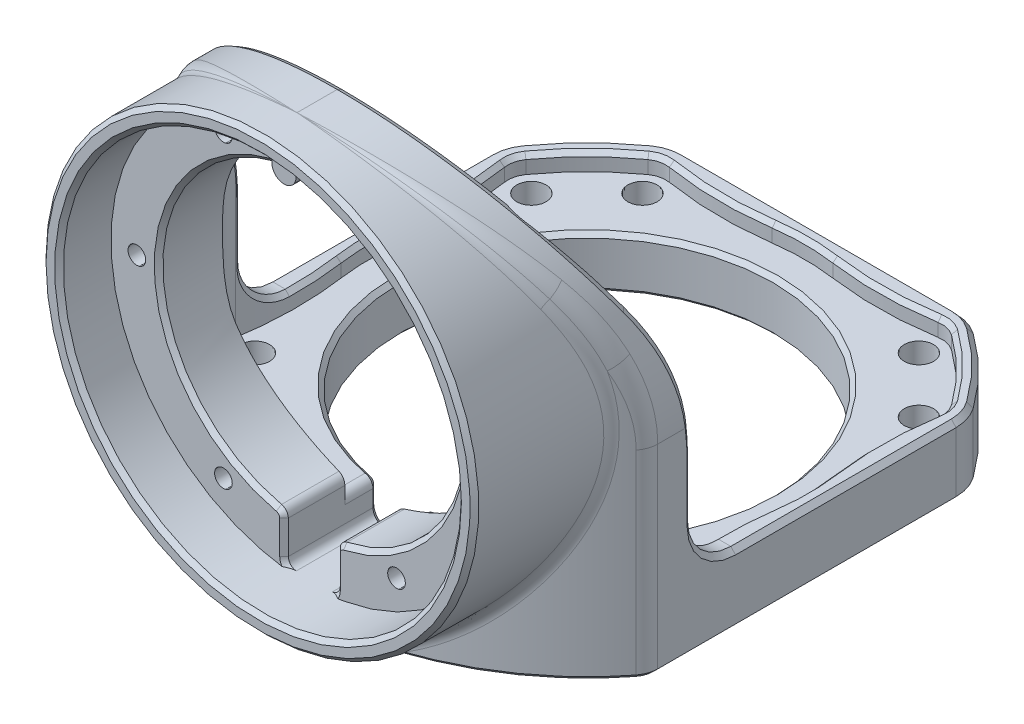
SolidWorks part; units mm, degrees
ref_plane "前视基准面" through (0, 0, 0) normal (0, 0, 1) x (1, 0, 0)
ref_plane "上视基准面" through (0, 0, 0) normal (0, 1, 0) x (1, 0, 0)
ref_plane "右视基准面" through (0, 0, 0) normal (1, 0, 0) x (0, 0, -1)
other "Configuration Table"
sketch "草图1" plane through (0, 0, 0) normal (0, 1, 0) x (1, 0, 0)
  line B0 (0, 0) -> (0, 37.6754) construction
  line B1 (0, 0) -> (41.9518, 0) construction
  arc B2 (15.5614, -24.8547) -> (3.4705, -24.7074) centre (9.0345, -64.3186) ccw
  arc B3 (15.5614, -24.8547) -> (17.4211, -24.4235) centre (15.9693, -22.3882) ccw
  arc B4 (17.4211, -24.4235) -> (24.4235, -17.4211) centre (0, 0) ccw
  arc B5 (24.4235, -17.4211) -> (24.8547, -15.5614) centre (22.3882, -15.9693) ccw
  arc B6 (24.7074, -3.4705) -> (24.8547, -15.5614) centre (64.3186, -9.0345) ccw
  arc B7 (24.7074, -3.4705) -> (24.7074, 3.4705) centre (0, 0) ccw
  arc B8 (24.8547, 15.5614) -> (24.7074, 3.4705) centre (64.3186, 9.0345) ccw
  arc B9 (24.8547, 15.5614) -> (24.4235, 17.4211) centre (22.3882, 15.9693) ccw
  arc B10 (24.4235, 17.4211) -> (17.4211, 24.4235) centre (0, 0) ccw
  arc B11 (17.4211, 24.4235) -> (15.5614, 24.8547) centre (15.9693, 22.3882) ccw
  arc B12 (3.4705, 24.7074) -> (15.5614, 24.8547) centre (9.0345, 64.3186) ccw
  arc B13 (3.4705, 24.7074) -> (-3.4705, 24.7074) centre (0, 0) ccw
  arc B14 (-15.5614, 24.8547) -> (-3.4705, 24.7074) centre (-9.0345, 64.3186) ccw
  arc B15 (-15.5614, 24.8547) -> (-17.4211, 24.4235) centre (-15.9693, 22.3882) ccw
  arc B16 (-17.4211, 24.4235) -> (-24.4235, 17.4211) centre (0, 0) ccw
  arc B17 (-24.4235, 17.4211) -> (-24.8547, 15.5614) centre (-22.3882, 15.9693) ccw
  arc B18 (-24.7074, 3.4705) -> (-24.8547, 15.5614) centre (-64.3186, 9.0345) ccw
  arc B19 (-24.7074, 3.4705) -> (-24.7074, -3.4705) centre (0, 0) ccw
  arc B20 (-24.8547, -15.5614) -> (-24.7074, -3.4705) centre (-64.3186, -9.0345) ccw
  arc B21 (-24.8547, -15.5614) -> (-24.4235, -17.4211) centre (-22.3882, -15.9693) ccw
  arc B22 (-24.4235, -17.4211) -> (-17.4211, -24.4235) centre (0, 0) ccw
  arc B23 (-17.4211, -24.4235) -> (-15.5614, -24.8547) centre (-15.9693, -22.3882) ccw
  arc B24 (-3.4705, -24.7074) -> (-15.5614, -24.8547) centre (-9.0345, -64.3186) ccw
  arc B25 (-3.4705, -24.7074) -> (3.4705, -24.7074) centre (0, 0) ccw
sketch_block_instance "块1-1"
sketch_block "块1"
sketch "草图2" plane through (0, 0, 0) normal (0, 1, 0) x (1, 0, 0)
  line L1 (-27, -27) -> (27, -27)
  line L2 (-27, -27) -> (-27, 27)
  line L3 (-27, 27) -> (27, 27)
  line L4 (27, -27) -> (27, 27)
  line L5 (-27, -27) -> (27, 27) construction
  line L6 (-27, 27) -> (27, -27) construction
  circle A0 centre (0, 0) radius 32
  arc A302 (24.4235, 17.4211) -> (17.4211, 24.4235) centre (0, 0) ccw construction
  circle A303 centre (0, 0) radius 33.5
  arc A304 (17.4211, -24.4235) -> (24.4235, -17.4211) centre (0, 0) ccw construction
  arc A326 (24.9055, -3.4984) -> (24.9055, 3.4984) centre (0, 0) ccw
  arc A327 (24.9055, -3.4984) -> (25.052, -15.5288) centre (64.3186, -9.0345) ccw
  arc A328 (24.5863, -17.5372) -> (25.052, -15.5288) centre (22.3882, -15.9693) ccw
  arc A329 (17.5372, -24.5863) -> (24.5863, -17.5372) centre (0, 0) ccw
  arc A330 (15.5288, -25.052) -> (17.5372, -24.5863) centre (15.9693, -22.3882) ccw
  arc A331 (15.5288, -25.052) -> (3.4984, -24.9055) centre (9.0345, -64.3186) ccw
  arc A332 (-3.4984, -24.9055) -> (3.4984, -24.9055) centre (0, 0) ccw
  arc A333 (-3.4984, -24.9055) -> (-15.5288, -25.052) centre (-9.0345, -64.3186) ccw
  arc A334 (-17.5372, -24.5863) -> (-15.5288, -25.052) centre (-15.9693, -22.3882) ccw
  arc A335 (-24.5863, -17.5372) -> (-17.5372, -24.5863) centre (0, 0) ccw
  arc A336 (-25.052, -15.5288) -> (-24.5863, -17.5372) centre (-22.3882, -15.9693) ccw
  arc A337 (-25.052, -15.5288) -> (-24.9055, -3.4984) centre (-64.3186, -9.0345) ccw
  arc A338 (-24.9055, 3.4984) -> (-24.9055, -3.4984) centre (0, 0) ccw
  arc A339 (-24.9055, 3.4984) -> (-25.052, 15.5288) centre (-64.3186, 9.0345) ccw
  arc A340 (-24.5863, 17.5372) -> (-25.052, 15.5288) centre (-22.3882, 15.9693) ccw
  arc A341 (-17.5372, 24.5863) -> (-24.5863, 17.5372) centre (0, 0) ccw
  arc A342 (-15.5288, 25.052) -> (-17.5372, 24.5863) centre (-15.9693, 22.3882) ccw
  arc A343 (-15.5288, 25.052) -> (-3.4984, 24.9055) centre (-9.0345, 64.3186) ccw
  arc A344 (3.4984, 24.9055) -> (-3.4984, 24.9055) centre (0, 0) ccw
  arc A345 (3.4984, 24.9055) -> (15.5288, 25.052) centre (9.0345, 64.3186) ccw
  arc A346 (17.5372, 24.5863) -> (15.5288, 25.052) centre (15.9693, 22.3882) ccw
  arc A347 (24.5863, 17.5372) -> (17.5372, 24.5863) centre (0, 0) ccw
  arc A348 (25.052, 15.5288) -> (24.5863, 17.5372) centre (22.3882, 15.9693) ccw
  arc A349 (25.052, 15.5288) -> (24.9055, 3.4984) centre (64.3186, 9.0345) ccw
  arc A350 (24.9055, -3.4984) -> (24.9055, 3.4984) centre (0, 0) ccw
  arc A351 (24.9055, -3.4984) -> (25.052, -15.5288) centre (64.3186, -9.0345) ccw
  arc A352 (24.5863, -17.5372) -> (25.052, -15.5288) centre (22.3882, -15.9693) ccw
  arc A353 (17.5372, -24.5863) -> (24.5863, -17.5372) centre (0, 0) ccw
  arc A354 (15.5288, -25.052) -> (17.5372, -24.5863) centre (15.9693, -22.3882) ccw
  arc A355 (15.5288, -25.052) -> (3.4984, -24.9055) centre (9.0345, -64.3186) ccw
  arc A356 (-3.4984, -24.9055) -> (3.4984, -24.9055) centre (0, 0) ccw
  arc A357 (-3.4984, -24.9055) -> (-15.5288, -25.052) centre (-9.0345, -64.3186) ccw
  arc A358 (-17.5372, -24.5863) -> (-15.5288, -25.052) centre (-15.9693, -22.3882) ccw
  arc A359 (-24.5863, -17.5372) -> (-17.5372, -24.5863) centre (0, 0) ccw
  arc A360 (-25.052, -15.5288) -> (-24.5863, -17.5372) centre (-22.3882, -15.9693) ccw
  arc A361 (-25.052, -15.5288) -> (-24.9055, -3.4984) centre (-64.3186, -9.0345) ccw
  arc A362 (-24.9055, 3.4984) -> (-24.9055, -3.4984) centre (0, 0) ccw
  arc A363 (-24.9055, 3.4984) -> (-25.052, 15.5288) centre (-64.3186, 9.0345) ccw
  arc A364 (-24.5863, 17.5372) -> (-25.052, 15.5288) centre (-22.3882, 15.9693) ccw
  arc A365 (-17.5372, 24.5863) -> (-24.5863, 17.5372) centre (0, 0) ccw
  arc A366 (-15.5288, 25.052) -> (-17.5372, 24.5863) centre (-15.9693, 22.3882) ccw
  arc A367 (-15.5288, 25.052) -> (-3.4984, 24.9055) centre (-9.0345, 64.3186) ccw
  arc A368 (3.4984, 24.9055) -> (-3.4984, 24.9055) centre (0, 0) ccw
  arc A369 (3.4984, 24.9055) -> (15.5288, 25.052) centre (9.0345, 64.3186) ccw
  arc A370 (17.5372, 24.5863) -> (15.5288, 25.052) centre (15.9693, 22.3882) ccw
  arc A371 (24.5863, 17.5372) -> (17.5372, 24.5863) centre (0, 0) ccw
  arc A372 (25.052, 15.5288) -> (24.5863, 17.5372) centre (22.3882, 15.9693) ccw
  arc A373 (25.052, 15.5288) -> (24.9055, 3.4984) centre (64.3186, 9.0345) ccw
  dimension "D2" = 2
  dimension "D4" = 3.5
  dimension "D3" = 54
  dimension "D1" = 0.2
extrude "凸台-拉伸1" add sketch "草图2" along normal blind 44 contours L1 A0 L4 L3 L2 A372 A373 A350 A351 A352 A353 A354 A355 A356 A357 A358 A359 A360 A361 A362 A363 A364 A365 A366 A367 A368 A369 A370 A371 | L2 A303 L1 A0 | L1 A303 A0 | L1 A0 | L1 A303 L4 A0
sketch "草图3" plane through (0, 0, 0) normal (0, -1, 0) x (1, 0, 0)
  line L3 (-27, 19.8305) -> (-27, -17.1756)
  line L4 (-17.1756, -27) -> (17.1756, -27)
  line L5 (27, -17.1756) -> (27, 19.8305)
  line L6 (-27, 19.8305) -> (-27, -17.1756)
  line L7 (-17.1756, -27) -> (17.1756, -27)
  line L8 (27, -17.1756) -> (27, 19.8305)
  arc A3 (27, 19.8305) -> (-27, 19.8305) centre (0, 0) ccw
  arc A4 (-27, -17.1756) -> (-17.1756, -27) centre (0, 0) ccw
  arc A5 (17.1756, -27) -> (27, -17.1756) centre (0, 0) ccw
  arc A6 (27, 19.8305) -> (-27, 19.8305) centre (0, 0) ccw
  arc A7 (-27, -17.1756) -> (-17.1756, -27) centre (0, 0) ccw
  arc A8 (17.1756, -27) -> (27, -17.1756) centre (0, 0) ccw
  dimension "D1" = 0
extrude "凸台-拉伸2" add sketch "草图3" along normal blind 6
sketch "草图4" plane through (0, 0, 0) normal (1, 0, 0) x (0, 0, -1)
  line L0 (-14.8305, 44) -> (-14.8305, 2)
  line L2 (-14.8305, 2) -> (36.4104, 2)
  line L3 (36.4104, 2) -> (36.4104, 44)
  line L4 (36.4104, 44) -> (-14.8305, 44)
  line L5 (17.1756, -6) -> (-19.8305, -6) construction
  line L6 (-19.8305, 44) -> (17.1756, 44) construction
  line L7 (-19.8305, 44) -> (-19.8305, -6) construction
  dimension "D1" = 8
  dimension "D2" = 5
extrude "切除-拉伸1" cut sketch "草图4" against normal through all both and the other way through all
sketch "草图6" plane through (0, -6, 0) normal (0, -1, 0) x (1, 0, 0)
  circle A0 centre (0, 0) radius 21.5
  dimension "D1" = 43
extrude "切除-拉伸2" cut sketch "草图6" against normal through all
ref_plane "基准面1" through (0, 0, 33.5) normal (0, 0, 1) x (1, 0, 0)
sketch "草图5" plane through (0, 0, 33.5) normal (0, 0, 1) x (1, 0, 0)
  line L0 (0, -6) -> (0, 19) construction
  line L1 (-27, -6) -> (27, -6) construction
  circle A0 centre (0, 19) radius 25
  dimension "D1" = 50
  dimension "D2" = 25
extrude "凸台-拉伸3" add sketch "草图5" along normal blind 4.5 and the other way up to surface
fillet "圆角6" radius 27 2 edges at (-27, 44, 17.3305) (27, 44, 17.3305)
sketch "草图8" plane through (0, 0, 0) normal (1, 0, 0) x (0, 0, -1)
  line L0 (-28.5, 44) -> (-14.8305, 22)
  line L3 (-14.8305, 22) -> (-14.8305, 49.0838)
  line L4 (-14.8305, 49.0838) -> (-28.5, 49.0838)
  line L5 (-28.5, 49.0838) -> (-28.5, 44)
  line L6 (-38, 44) -> (-38, -6) construction
  line L7 (-38, 44) -> (-38, -6) construction
  line L8 (17.1756, -6) -> (-19.8305, -6) construction
  line L9 (-14.8305, 17) -> (-14.8305, 27.337) construction
  line L10 (-33.5, 44) -> (-25.15, 44) construction
  dimension "D1" = 5
  dimension "D2" = 28
extrude "切除-拉伸5" cut sketch "草图8" against normal through all both and the other way through all
fillet "圆角3" radius 5 2 edges at (-25.9714, 2, 14.8305) (25.9714, 2, 14.8305)
fillet "圆角7" radius 30 2 edges at (-25.7379, 22, 14.8305) (25.7379, 22, 14.8305)
fillet "圆角9" radius 5 4 edges at (27, -2, -17.1756) (17.1756, -2, -27) (-17.1756, -2, -27) (-27, -2, -17.1756)
chamfer "倒角3" distance 0.5 angle 45 20 edges at (22.6274, 2, -22.6274) (17.1739, 2, -26.7629) (26.7629, 2, -17.1739) (0, 2, -27) (27, 2, -2.911) (-17.1739, 2, -26.7629) (27, 3.4645, 13.3661) (-22.6274, 2, -22.6274) (27, 10.2194, 14.8305) (-26.7629, 2, -17.1739) (27, 15.2226, 14.8836) (-27, 2, -2.911) (25.9683, 24.3923, 16.9016) (-27, 3.4645, 13.3661) (-27, 10.2194, 14.8305) (-21.4356, 33.4169, 21.9243) (-8.6515, 42.5764, 27.6155) (-27, 15.2226, 14.8836) (-26.4134, 22.5975, 16.2627) (21.4356, 33.4169, 21.9243)
chamfer "倒角4" distance 0.5 angle 45 27 edges at (-24.7109, 3.0867, 12.9428) (-24.8063, 25.0543, 17.1704) (-24.5897, 2, 6.6569) (-25.15, 2, 0) (-24.5215, 2, -9.5191) (-25.0184, 2, -16.5792) (-21.3546, 2, -21.3546) (-16.5792, 2, -25.0184) (-9.5191, 2, -24.5215) (0, 2, -25.15) (9.5191, 2, -24.5215) (16.5792, 2, -25.0184) (25.0813, 22.2761, 16.1617) (21.3546, 2, -21.3546) (25.0184, 2, -16.5792) (24.5215, 2, -9.5191) (24.799, 3.8963, 13.7506) (25.15, 2, 0) (24.5897, 2, 6.6569) (-24.9429, 10.2194, 14.8305) (24.9429, 10.2194, 14.8305)
sketch "草图9" plane through (0, -6, 0) normal (0, -1, 0) x (1, 0, 0)
  line L0 (0, 0) -> (0, 61.8935)
  line L1 (0, 0) -> (-15.9693, 22.3882)
  line L2 (0, 0) -> (-22.3882, 15.9693)
  circle A0 centre (0, 0) radius 27.5
  dimension "D1" = 55
  dimension "D2" = 19
  dimension "D3" = 35.5
hole_wizard "打孔尺寸(%根据)内六角圆柱头螺钉的类型1" positions "3D草图2" profile "草图11" counterbore size "M3" standard "GB"
sketch3d "3D草图2"
  point P0 (-15.9693, -6, 22.3882)
  point P3 (-22.3882, -6, 15.9693)
sketch "草图11" plane through (-15.9693, -6, 22.3882) normal (1, 0, 0) x (0, 0, -1)
  line L0 (0, 0) -> (0, 50.0003)
  line L1 (0, 50.0003) -> (1.7, 50.0003)
  line L3 (1.7, 50.0003) -> (1.7, 3.4)
  line L4 (1.7, 3.4) -> (3, 3.4)
  line L5 (3, 3.4) -> (3, 0)
  line L7 (3, 0) -> (0, 0)
  line L11 (0, -6.35) -> (0, 107.95) construction
  dimension "通孔孔直径" = 3.4
  dimension "通孔孔深度" = 50.0003
  dimension "柱形沉头孔直径" = 6
  dimension "柱形沉头孔深度" = 3.4
pattern_circular "阵列(圆周)1" count 4 over 360 about axis through (0, 0, 0) along (0, 1, 0) of "打孔尺寸(%根据)内六角圆柱头螺钉的类型1"
sketch "草图12" plane through (0, 0, 38) normal (0, 0, 1) x (1, 0, 0)
  circle A0 centre (0, 19) radius 15
  dimension "D1" = 30
sketch "草图13" plane through (0, 0, 38) normal (0, 0, 1) x (1, 0, 0)
  circle A0 centre (0, 19) radius 23
  dimension "D1" = 46
extrude "切除-拉伸6" cut sketch "草图13" against normal blind 6
sketch "草图14" plane through (0, 0, 32) normal (0, 0, 1) x (1, 0, 0)
  line L0 (0, 19) -> (10, 36.3205) construction
  line L1 (0, 19) -> (0, 58.3254) construction
  circle A0 centre (0, 19) radius 20 construction
  dimension "D1" = 40
  dimension "D2" = 30
hole_wizard "M2.5 螺纹孔1" positions "3D草图4" profile "草图15" tap size "M2.5" standard "GB"
sketch3d "3D草图4"
  point P0 (10, 36.3205, 32)
sketch "草图15" plane through (10, 36.3205, 32) normal (1, 0, 0) x (0, -1, 0)
  line L0 (0, 0) -> (0, 6.9659)
  line L1 (0, 6.9659) -> (1.025, 6.35)
  line L2 (1.025, 6.35) -> (1.025, 0)
  line L5 (1.025, 0) -> (0, 0)
  line L10 (0, 6.9659) -> (-1.025, 6.35) construction
  line L11 (0, -6.35) -> (0, 107.95) construction
  dimension "螺纹孔钻头直径" = 2.05
  dimension "螺纹孔钻头深度" = 6.35
  dimension "导头角度" = 118
pattern_circular "阵列(圆周)2" count 6 over 360 about axis through (0, 19, 0) along (0, 0, 1) of "M2.5 螺纹孔1"
sketch "草图16" plane through (0, 0, 32) normal (0, 0, 1) x (1, 0, 0)
  circle A0 centre (0, 19) radius 17.5
  dimension "D1" = 35
extrude "切除-拉伸7" cut sketch "草图16" against normal blind 10
sketch "草图17" plane through (0, 0, 32) normal (0, 0, 1) x (1, 0, 0)
  line L0 (0, 39) -> (0, 45) construction
  line L1 (-1.4, 39) -> (-1.4, 45)
  line L2 (1.4, 39) -> (1.4, 45)
  circle A0 centre (0, 19) radius 23 construction
  circle A1 centre (0, 19) radius 23
  arc A2 (-1.4, 39) -> (1.4, 39) centre (0, 39) ccw
  arc A3 (1.4, 45) -> (-1.4, 45) centre (0, 45) ccw
  point P5 (0, 42)
  dimension "D1" = 1.4
  dimension "D2" = 20
extrude "凸台-拉伸4" add sketch "草图17" along normal blind 3
fillet "圆角10" radius 1 2 edges at (-1.4, 41.9574, 33.5) (1.4, 41.9574, 33.5)
sketch "草图18" plane through (0, 0, 32) normal (0, 0, 1) x (1, 0, 0)
  line L0 (0, -4) -> (0, 19) construction
  line L2 (-3, -4.6882) -> (3, -4.6882)
  line L3 (-3, -4.6882) -> (-3, 6.4495)
  line L4 (-3, 6.4495) -> (3, 6.4495)
  line L5 (3, -4.6882) -> (3, 6.4495)
  line L6 (-3, -4.6882) -> (3, 6.4495) construction
  line L7 (-3, 6.4495) -> (3, -4.6882) construction
  arc A0 (-2.5091, 41.8627) -> (2.5091, 41.8627) centre (0, 19) ccw construction
  arc A1 (-2.5091, 41.8627) -> (2.5091, 41.8627) centre (0, 19) ccw
  circle A2 centre (0, 19) radius 17.5 construction
  circle A3 centre (0, 19) radius 17.5
  point P7 (0, 0.8806)
  dimension "D1" = 6
extrude "切除-拉伸8" cut sketch "草图18" against normal blind 20 contours L5 L3 M6 M10
fillet "圆角11" radius 1 4 edges at (3, 1.7591, 28.4852) (-3, 1.7591, 28.4852) (-3, -3.8035, 26.6448) (3, -3.8035, 26.6448)
fillet "圆角12" radius 1 2 edges at (-3, 0, 23.1301) (3, 0, 23.1301)
chamfer "倒角5" distance 0.5 angle 45 9 edges at (3.2151, -0.3803, 21.2582) (3, -1.9545, 21.2897) (2.6955, -3.6274, 21.3304) (-2.7842, -3.5294, 21.319) (-3, -1.9545, 21.2897) (-3.369, -0.2242, 21.2344) (0, 0, -21.5) (0, -6, -21.5)
fillet "圆角13" radius 2 2 edges at (-24.4737, 24.1029, 22.8755) (-24.4737, 24.1029, 22.8755)
fillet "圆角14" radius 3 6 edges at (27, 5.5, 19.8305) (26.346, 22.9065, 20.6915) (10.0558, 42.0576, 31.9551) (-7.6048, 42.9069, 32.6254) (-27, 5.5, 19.8305) (-25.7624, 25.0807, 21.4137)
chamfer "倒角6" distance 0.5 angle 45 15 edges at (-4.8633, -6, 33.1451) (4.8633, -6, 33.1451) (-18.8757, -6, 27.676) (18.8757, -6, 27.676) (-26.8357, -6, 19.8008) (26.8357, -6, 19.8008) (-27, -6, 1.5845) (27, -6, 1.5845) (-26.7629, -6, -17.1739) (26.7629, -6, -17.1739) (-22.6274, -6, -22.6274) (22.6274, -6, -22.6274) (-17.1739, -6, -26.7629) (17.1739, -6, -26.7629) (0, -6, -27)
chamfer "倒角7" distance 0.5 angle 45 2 edges at (25, 19, 38) (23, 19, 38)
chamfer "倒角8" distance 0.5 angle 45 7 edges at (2.7385, -3.5831, 32) (-2.7385, -3.5831, 32) (3, -0.9856, 32) (-3, -0.9856, 32) (3.2202, 1.5636, 32) (-3.2202, 1.5636, 32) (0, 36.5, 32)
sketch "草图19" plane through (0, 2, 0) normal (0, 1, 0) x (1, 0, 0)
  line L0 (0, 0) -> (0, 27) construction
  line L1 (-15.6525, 27) -> (15.6525, 27) construction
  line L2 (0, 27.4716) -> (0, 27) construction
  line L5 (0.5, 27.4716) -> (0.5, 27)
  line L6 (-0.5, 27.4716) -> (-0.5, 27)
  arc A2 (0.5, 27.4716) -> (-0.5, 27.4716) centre (0, 27.4716) ccw
  arc A3 (-0.5, 27) -> (0.5, 27) centre (0, 27) ccw
  point P6 (0, 27.2358)
  dimension "D1" = 0.5
extrude "切除-拉伸9" cut sketch "草图19" against normal through all both and the other way through all
sketch "草图20" plane through (0, -6, 0) normal (0, -1, 0) x (1, 0, 0)
  line L0 (0, 10.5574) -> (0, 26) construction
  line L1 (-0.5, 10.5574) -> (-0.5, 26)
  line L2 (0.5, 10.5574) -> (0.5, 26)
  arc A0 (-0.5, 10.5574) -> (0.5, 10.5574) centre (0, 10.5574) ccw
  arc A1 (0.5, 26) -> (-0.5, 26) centre (0, 26) ccw
  point P2 (0, 18.2787)
  dimension "D1" = 0.5
  dimension "D2" = 26
extrude "切除-拉伸10" cut sketch "草图20" against normal blind 0.5
